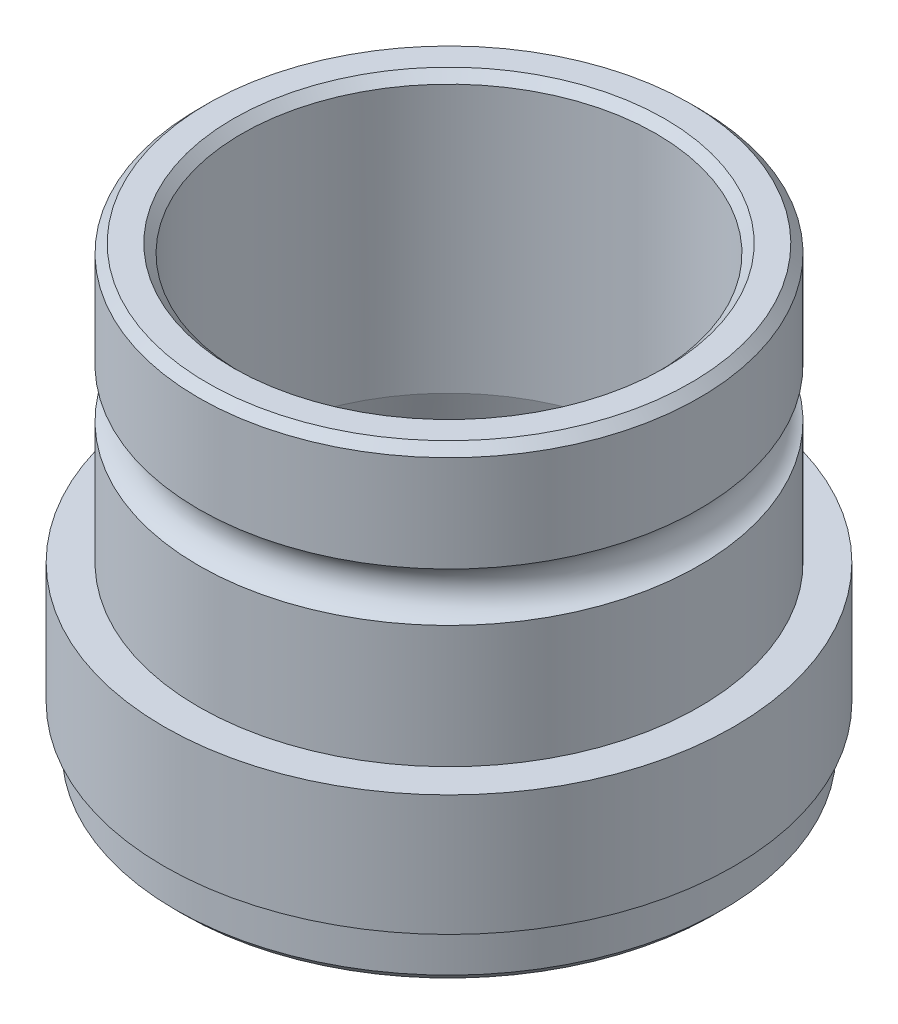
SolidWorks part; units mm, degrees
ref_plane "正面" through (0, 0, 0) normal (0, 0, 1) x (1, 0, 0)
ref_plane "平面" through (0, 0, 0) normal (0, 1, 0) x (1, 0, 0)
ref_plane "右側面" through (0, 0, 0) normal (1, 0, 0) x (0, 0, -1)
sketch "ｽｹｯﾁ1" plane through (0, 0, 0) normal (0, 0, 1) x (1, 0, 0)
  line L0 (0, 0) -> (-16.5, 0)
  line L1 (-16.5, 0) -> (-16.5, 10)
  line L2 (-16.5, 10) -> (-14.5, 10)
  line L3 (-14.5, 10) -> (-14.5, 26)
  line L4 (-14.5, 26) -> (0, 26)
  line L5 (0, 26) -> (0, 0)
  line L6 (-12, 10) -> (-12, 26)
  line L7 (-14, 0) -> (-14, 10) construction
  line L8 (-14, 0) -> (-12, 10)
  line L9 (-14, 0) -> (-14, 10) construction
  line L10 (-15.85, 3) -> (-15.85, 0)
  line L11 (-15.85, 3) -> (-16.5, 3)
  line L12 (0, 3) -> (-16.5, 3) construction
  line L13 (-15.85, 26) -> (-15.85, 0) construction
  circle A0 centre (-15, 18.5) radius 1.5
  point P14 (-14, -0.2196)
  point P15 (-12, 9.8191)
  point P17 (-14, 0)
  point P18 (-13.9522, 0.2391)
  dimension "D5" = 3
  dimension "D1" = 16.5
  dimension "D2" = 10
  dimension "D3" = 14.5
  dimension "D4" = 7.5
  dimension "D6" = 16
  dimension "D7" = 15
  dimension "D8" = 2.5
  dimension "D9" = 2.5
  dimension "D10" = 15.85
  dimension "D11" = 3
revolve "回転1" add sketch "ｽｹｯﾁ1" angle 360 about L5
chamfer "面取り1" distance 0.5 angle 45 4 edges at (0, 0, 14) (0, 0, 15.85) (0, 26, 12) (0, 26, 14.5)
